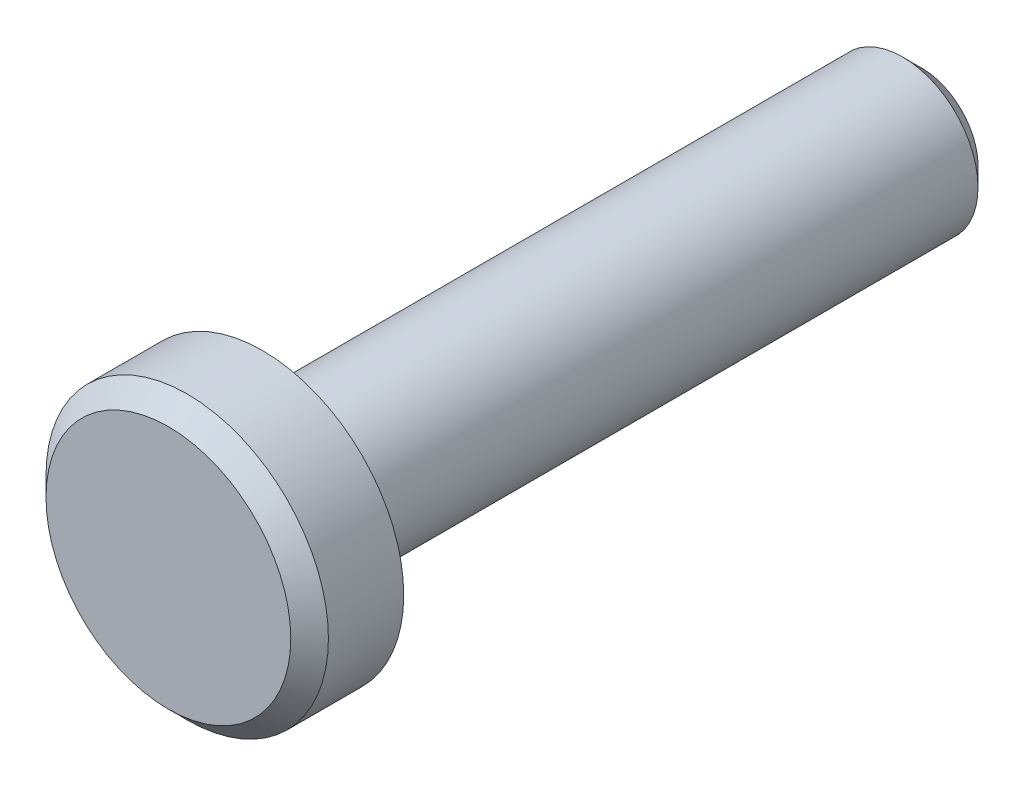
SolidWorks part; units mm, degrees
ref_plane "Frontal" through (0, 0, 0) normal (0, 0, 1) x (1, 0, 0)
ref_plane "Superior" through (0, 0, 0) normal (0, 1, 0) x (1, 0, 0)
ref_plane "Derecha" through (0, 0, 0) normal (1, 0, 0) x (0, 0, -1)
sketch "Croquis1" plane through (0, 0, 0) normal (0, 0, 1) x (1, 0, 0)
  circle A0 centre (0, 0) radius 7.5
  dimension "D1" = 15
extrude "Extruir1" add sketch "Croquis1" along normal blind 5
sketch "Croquis2" plane through (0, 0, 0) normal (0, 0, -1) x (-1, 0, 0)
  circle A0 centre (0, 0) radius 4
  dimension "D1" = 8
extrude "Extruir2" add sketch "Croquis2" along normal blind 35
chamfer "Chaflán1" distance 1 angle 45 2 edges at (7.5, 0, 5) (-4, 0, -35)
